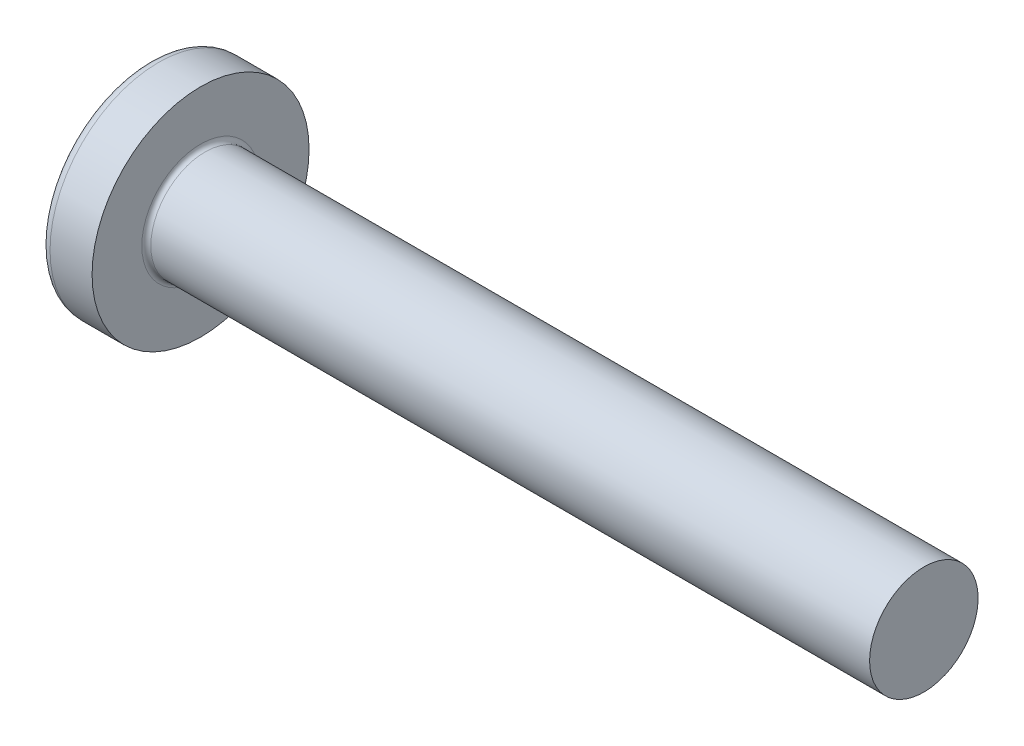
SolidWorks part; units mm, degrees
ref_plane "Plane1" through (0, 0, 0) normal (0, 0, 1) x (1, 0, 0)
ref_plane "Plane2" through (0, 0, 0) normal (0, 1, 0) x (1, 0, 0)
ref_plane "Plane3" through (0, 0, 0) normal (1, 0, 0) x (0, 0, -1)
sketch "BodySke" plane through (0, 0, 0) normal (0, 0, 1) x (1, 0, 0)
  line L0 (4.6, 3) -> (4.6, 6)
  line L1 (5.1, 6.35) -> (5.1, -3.175) construction
  line L2 (-25.4, 0) -> (127, 0) construction
  line L3 (44.6, 0) -> (0, 0)
  line L4 (4.6, 3) -> (44.6, 3)
  line L5 (44.6, 3) -> (44.6, 0)
  line L6 (2.2747, 6) -> (4.6, 6)
  line L8 (4.6, 6.35) -> (4.6, -3.175) construction
  arc A0 (1.8337, 5.7717) -> (0, 0) centre (10, 0) ccw
  arc A2 (1.8337, 5.7717) -> (2.2747, 6) centre (2.2747, 5.46) cw
revolve "Base-Revolve" add sketch "BodySke"
fillet "Fillet1" radius 0.25 1 edges at (4.6, 0, 3)
sketch "Sketch3" plane through (0, 0, 0) normal (1, 0, 0) x (0, 0, -1)
  line L0 (0.71, -3.35) -> (-0.71, -3.35)
  line L1 (0.71, -3.35) -> (0.71, 3.35)
  line L2 (-0.71, 3.35) -> (0.71, 3.35)
  line L3 (-0.71, 3.35) -> (-0.71, -3.35)
ref_plane "Plane4" through (3.46, 0, 0) normal (1, 0, 0) x (0, 0, -1)
sketch "Sketch4" plane through (3.46, 0, 0) normal (1, 0, 0) x (0, 0, -1)
  line L0 (0.71, -1.6249) -> (-0.71, -1.6249)
  line L1 (0.71, -1.6249) -> (0.71, 1.6249)
  line L2 (-0.71, 1.6249) -> (0.71, 1.6249)
  line L3 (-0.71, 1.6249) -> (-0.71, -1.6249)
loft "Recess" cut profiles "Sketch3", "Sketch4"
pattern_circular "RecPat" count 2 every 90 about axis through (0, 0, 0) along (1, 0, 0) of "Recess"
sketch "RecCorSke" plane through (0, 0, 0) normal (0, 0, 1) x (1, 0, 0)
  line L0 (-3.175, 0) -> (15.875, 0) construction
  line L1 (-25.4, 0) -> (127, 0) construction
  line L2 (0, 0) -> (0, 1.5224)
  line L3 (0, 1.5224) -> (3.46, 1.2805)
  line L4 (3.46, 1.2805) -> (3.8761, 0)
  line L5 (3.8761, 0) -> (0, 0)
revolve "RecessCore" cut sketch "RecCorSke" angle 360 about L0
sketch "ThdSchSke" plane through (0, 0, 0) normal (0, 0, 1) x (1, 0, 0)
  line L0 (6.6, -2.4455) -> (6.2117, -3)
  line L1 (6.6, -2.4455) -> (6.9883, -3)
  line L2 (6.9883, -3) -> (6.9883, -3.75)
  line L3 (-3.175, 0) -> (5.1513, 0) construction
  line L5 (6.9883, -3.75) -> (6.2117, -3.75)
  line L6 (6.2117, -3.75) -> (6.2117, -3)
revolve "ThreadSchematic" [suppressed] cut sketch "ThdSchSke" angle 360 about L3
pattern_linear "ThdSchPat" [suppressed]
equation "\"D1@Sketch3\" = \"Cross_dia@Sketch3\" / 2"
equation "\"D2@Sketch3\" = \"Cross_width@Sketch3\" / 2"
equation "\"Depth@RecCorSke\" = \"Cross_depth@Plane4\""
equation "\"D1@Sketch4\" = \"Cross_width@Sketch3\""
equation "\"D2@Sketch4\" = \"Cross_dia@Sketch3\" - 2.0 * \"Cross_depth@Plane4\" * tan(26.5  * 0.017453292)"
equation "\"D3@Sketch4\" = \"D1@Sketch4\" / 2"
equation "\"D4@Sketch4\" = \"D2@Sketch4\" / 2"
equation "\"Thread_length@ThreadCosmetic\" = ((sgn( (\"Length@BodySke\" - \"Advance@BodySke\" * 2.0 ) - \"Thread_nom@BodySke\" )-1)*( (\"Length@BodySke\" - \"Advance@BodySke\" * 2.0 ) - \"Thread_nom@BodySke\" ))/-2+ \"Thread_"
equation "\"Thread_minor@ThdSchSke\" = \"Thread_minor@ThreadCosmetic\""
equation "\"Diameter@ThdSchSke\" = \"Diameter@BodySke\""
equation "\"Overcut@ThdSchSke\" = \"Diameter@BodySke\" * 1.25"
equation "\"Start@ThdSchSke\" = \"Head_ht@BodySke\" + \"Length@BodySke\" - \"Thread_length@ThreadCosmetic\"  '---Non-countersunk---"
equation "\"Num_threads@ThdSchPat\" = int( \"Thread_length@ThreadCosmetic\" / \"Advance@BodySke\" + 0.999 )  + 1"
equation "\"Advance@ThdSchPat\" = \"Thread_length@ThreadCosmetic\" /  (\"Num_threads@ThdSchPat\" - 1) 'relax it"
